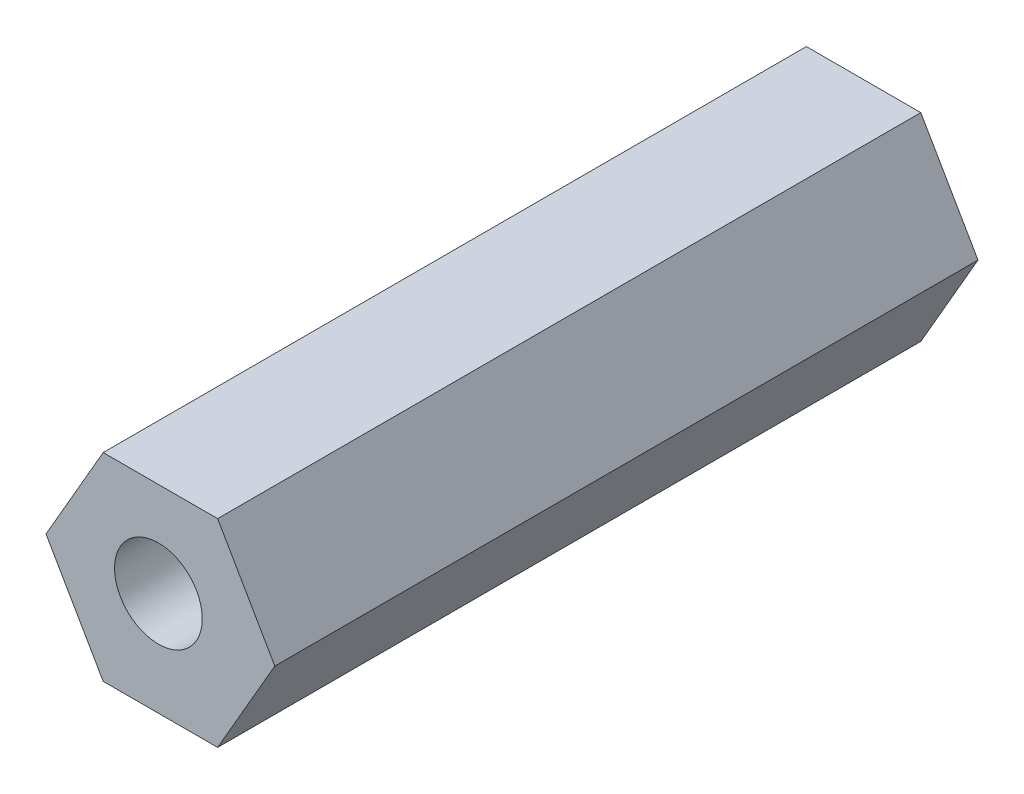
SolidWorks part; units mm, degrees
ref_plane "Front Plane" through (0, 0, 0) normal (0, 0, 1) x (1, 0, 0)
ref_plane "Top Plane" through (0, 0, 0) normal (0, 1, 0) x (1, 0, 0)
ref_plane "Right Plane" through (0, 0, 0) normal (1, 0, 0) x (0, 0, -1)
sketch "Sketch1" plane through (0, 0, 0) normal (0, 0, 1) x (1, 0, 0)
  line L0 (0, 0) -> (18.7003, 0) construction
  line L1 (5.4993, 9.525) -> (-5.4993, 9.525)
  line L2 (-5.4993, 9.525) -> (-10.9985, 0)
  line L3 (-10.9985, 0) -> (-5.4993, -9.525)
  line L4 (-5.4993, -9.525) -> (5.4993, -9.525)
  line L5 (5.4993, -9.525) -> (10.9985, 0)
  line L6 (10.9985, 0) -> (5.4993, 9.525)
  circle A0 centre (0, 0) radius 9.525 construction
  dimension "D1" = 19.05
  dimension "D2" = 120
extrude "Boss-Extrude1" add sketch "Sketch1" along normal blind 67.6
hole_wizard "3/8-24 Tapped Hole1" positions "Sketch3" profile "Sketch2" tap size "3/8-24" standard "Ansi Inch"
sketch "Sketch3" plane through (0, 0, 67.6) normal (0, 0, 1) x (1, 0, 0)
  point P0 (-0.1945, 0.4433)
sketch "Sketch2" plane through (-0.1945, 0.4433, 67.6) normal (1, 0, 0) x (0, -1, 0)
  line L0 (0, 0) -> (0, 67.6)
  line L1 (0, 67.6) -> (4.8514, 67.6)
  line L2 (4.2164, 66.965) -> (4.2164, 0)
  line L5 (4.2164, 0) -> (0, 0)
  line L7 (4.8514, 67.6) -> (4.2164, 66.965)
  line L8 (-4.8514, 67.6) -> (-4.2164, 66.965) construction
  line L11 (0, -6.35) -> (0, 107.95) construction
  dimension "Thru Tap Drill Dia." = 8.4328
  dimension "Thru Tap Drill Depth" = 67.6
  dimension "Far C'Sink Dia." = 9.7028
  dimension "Far C'Sink Angle" = 90
